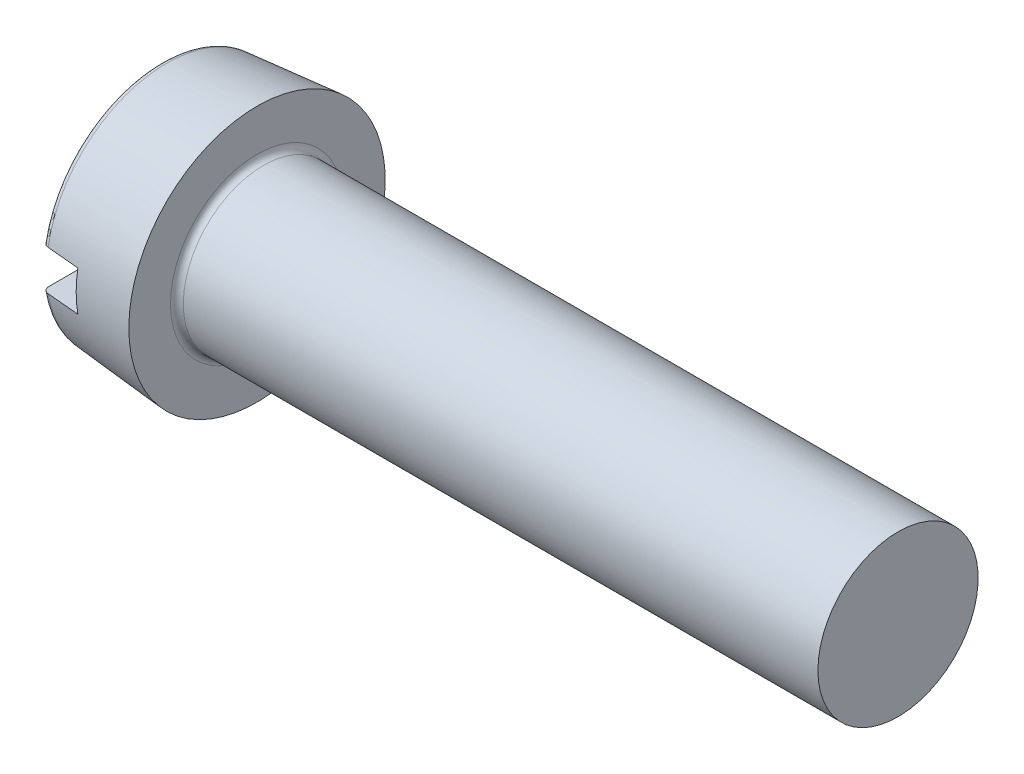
SolidWorks part; units mm, degrees
ref_plane "Front Plane" through (0, 0, 0) normal (0, 0, 1) x (1, 0, 0)
ref_plane "Top Plane" through (0, 0, 0) normal (0, 1, 0) x (1, 0, 0)
ref_plane "Right Plane" through (0, 0, 0) normal (1, 0, 0) x (0, 0, -1)
other "Configuration Table"
sketch "BodySke" plane through (0, 0, 0) normal (0, 0, 1) x (1, 0, 0)
  line L0 (0, 0) -> (154.7091, 0) construction
  line L1 (0, 0) -> (0, 7.4751)
  line L2 (0, 7.4751) -> (6, 8)
  line L3 (6, 8) -> (6, 5)
  line L4 (6, 5) -> (46, 5)
  line L5 (46, 5) -> (46, 0)
  line L6 (46, 0) -> (0, 0)
  line L7 (6, 0) -> (6, 8) construction
  line L8 (7.5, 0) -> (7.5, 8) construction
  point P12 (0, 4.172)
revolve "BaseBody" add sketch "BodySke" angle 360 about L0
fillet "Fillet1" radius 0.4 1 edges at (6, 0, 5)
fillet "Fillet2" radius 0.4 1 edges at (0, 0, 7.4751)
sketch "SlotSke" plane through (0, 0, 0) normal (-1, 0, 0) x (0, 0, 1)
  line L0 (8, -1.25) -> (-8, 1.25) construction
  line L1 (-8, 1.25) -> (8, 1.25)
  line L2 (-8, 1.25) -> (-8, -1.25)
  line L3 (-8, -1.25) -> (8, -1.25)
  line L4 (8, 1.25) -> (8, -1.25)
extrude "Slot" cut sketch "SlotSke" against normal blind 2.4
sketch "ThdSchSke" plane through (0, 0, 0) normal (0, 0, 1) x (1, 0, 0)
  line L0 (0, 0) -> (51.3012, 0) construction
  line L1 (45.522, 5) -> (45.522, 5.9561)
  line L2 (45.522, 5.9561) -> (46.478, 5.9561)
  line L3 (46.478, 5.9561) -> (46.478, 5)
  line L4 (46.478, 5) -> (46, 4.172)
  line L5 (46, 4.172) -> (45.522, 5)
  line L6 (46, 5) -> (46, 0) construction
  line L7 (6, 5) -> (46, 5) construction
revolve "ThreadSchematic" [suppressed] cut sketch "ThdSchSke" angle 360 about L0
pattern_linear "ThdSchPat" [suppressed]
equation "\"Thread_length@ThreadCosmetic\" = \"Thread_length@BodySke\""
equation "\"Thread_minor@ThreadCosmetic\" = \"Thread_minor@BodySke\""
equation "\"D1@SlotSke\" = \"Head_diameter@BodySke\""
equation "\"Advance@ThdSchPat\" = \"Advance@BodySke\""
equation "\"Tooth_Num@ThdSchPat\" =  int( \"Thread_length@BodySke\" / \"Advance@BodySke\" )"
